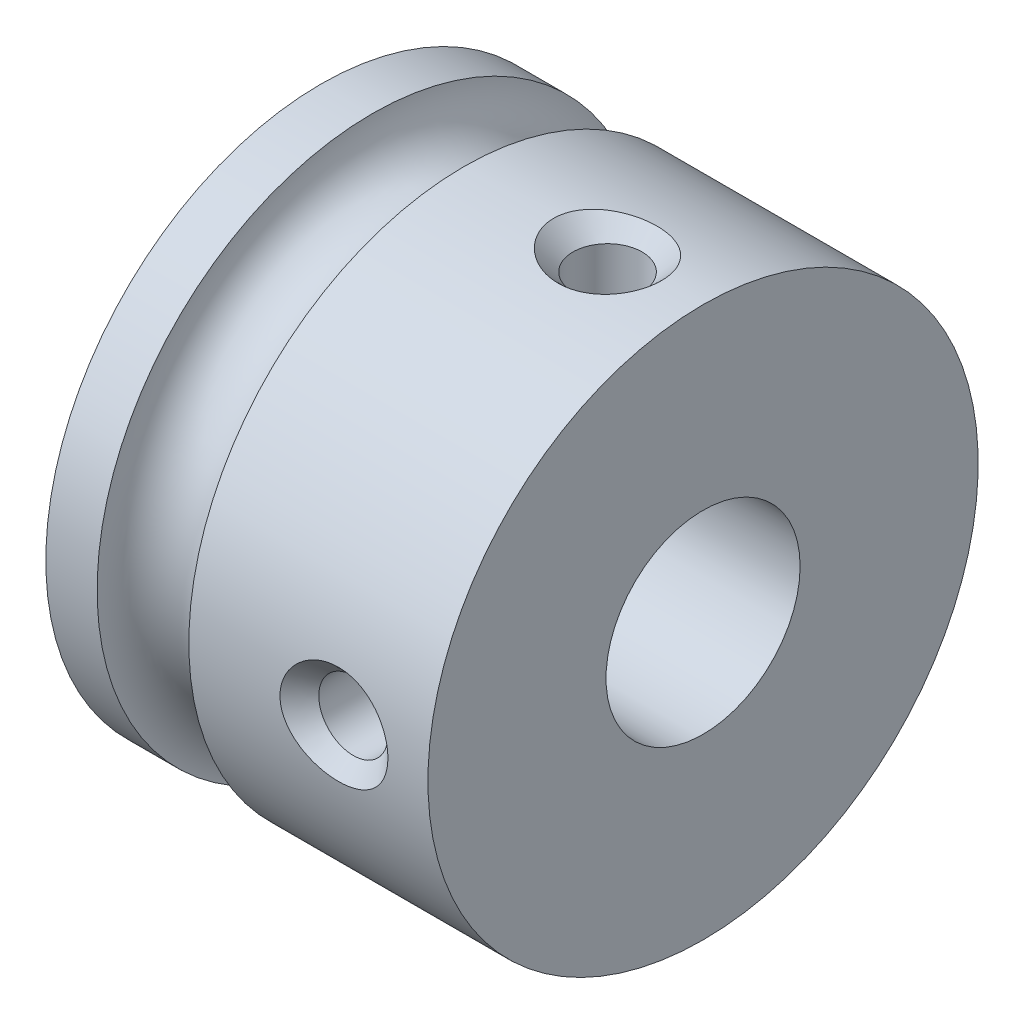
SolidWorks part; units mm, degrees
ref_plane "Front Plane" through (0, 0, 0) normal (0, 0, 1) x (1, 0, 0)
ref_plane "Top Plane" through (0, 0, 0) normal (0, 1, 0) x (1, 0, 0)
ref_plane "Right Plane" through (0, 0, 0) normal (1, 0, 0) x (0, 0, -1)
sketch "Sketch1" plane through (0, 0, 0) normal (0, 0, 1) x (1, 0, 0)
  line L0 (-27.9822, 0) -> (27.9822, 0) construction
  line L1 (-6.25, 9) -> (-4.5715, 9)
  line L2 (-6.25, 9) -> (-6.25, 0)
  line L3 (6.25, 9) -> (6.25, 0)
  line L4 (-6.25, 0) -> (6.25, 0)
  line L5 (6.25, 9) -> (-1.5715, 9)
  arc A0 (-4.5715, 9) -> (-1.5715, 9) centre (-3.0715, 9) ccw
  point P3 (0, 0)
  dimension "D1" = 1.5
  dimension "D2" = 12.5
  dimension "D3" = 9
revolve "Revolve1" add sketch "Sketch1" angle 360 about L0
hole_wizard "1/4 (0.25) Diameter Hole1" positions "Sketch3" profile "Sketch2" hole size "1/4" standard "Ansi Inch"
sketch "Sketch3" plane through (6.25, 0, 0) normal (1, 0, 0) x (0, 0, -1)
  point P0 (0, 0)
sketch "Sketch2" plane through (6.25, 0, 0) normal (0, 1, 0) x (0, 0, -1)
  line L0 (0, 0) -> (0, 12.5)
  line L1 (0, 12.5) -> (3.175, 12.5)
  line L2 (3.175, 12.5) -> (3.175, 0)
  line L5 (3.175, 0) -> (0, 0)
  line L11 (0, -6.35) -> (0, 107.95) construction
  dimension "Thru Hole Dia." = 6.35
  dimension "Thru Hole Depth" = 12.5
hole_wizard "#4-40 Tapped Hole3" positions "Sketch10" profile "Sketch9" tap size "#4-40" standard "Ansi Inch"
sketch "Sketch10" plane through (0, 0, 0) normal (0, 1, 0) x (1, 0, 0)
  point P3 (3.125, 0)
sketch "Sketch9" plane through (3.125, 0, 0) normal (1, 0, 0) x (0, 0, -1)
  line L0 (0, 0) -> (0, 9)
  line L1 (0, 9) -> (1.7653, 9)
  line L2 (1.1303, 8.365) -> (1.1303, 0)
  line L5 (1.1303, 0) -> (0, 0)
  line L7 (1.7653, 9) -> (1.1303, 8.365)
  line L8 (-1.7653, 9) -> (-1.1303, 8.365) construction
  line L11 (0, -6.35) -> (0, 107.95) construction
  dimension "Thru Tap Drill Dia." = 2.2606
  dimension "Thru Tap Drill Depth" = 9
  dimension "Far C'Sink Dia." = 3.5306
  dimension "Far C'Sink Angle" = 90
hole_wizard "#4-40 Tapped Hole4" positions "Sketch12" profile "Sketch13" tap size "#4-40" standard "Ansi Inch"
sketch "Sketch12" plane through (0, 0, 0) normal (0, 0, 1) x (1, 0, 0)
  point P1 (3.175, 0)
sketch "Sketch13" plane through (3.175, 0, 0) normal (1, 0, 0) x (0, 1, 0)
  line L0 (0, 0) -> (0, 9)
  line L1 (0, 9) -> (1.7653, 9)
  line L2 (1.1303, 8.365) -> (1.1303, 0)
  line L5 (1.1303, 0) -> (0, 0)
  line L7 (1.7653, 9) -> (1.1303, 8.365)
  line L8 (-1.7653, 9) -> (-1.1303, 8.365) construction
  line L11 (0, -6.35) -> (0, 107.95) construction
  dimension "Thru Tap Drill Dia." = 2.2606
  dimension "Thru Tap Drill Depth" = 9
  dimension "Far C'Sink Dia." = 3.5306
  dimension "Far C'Sink Angle" = 90
